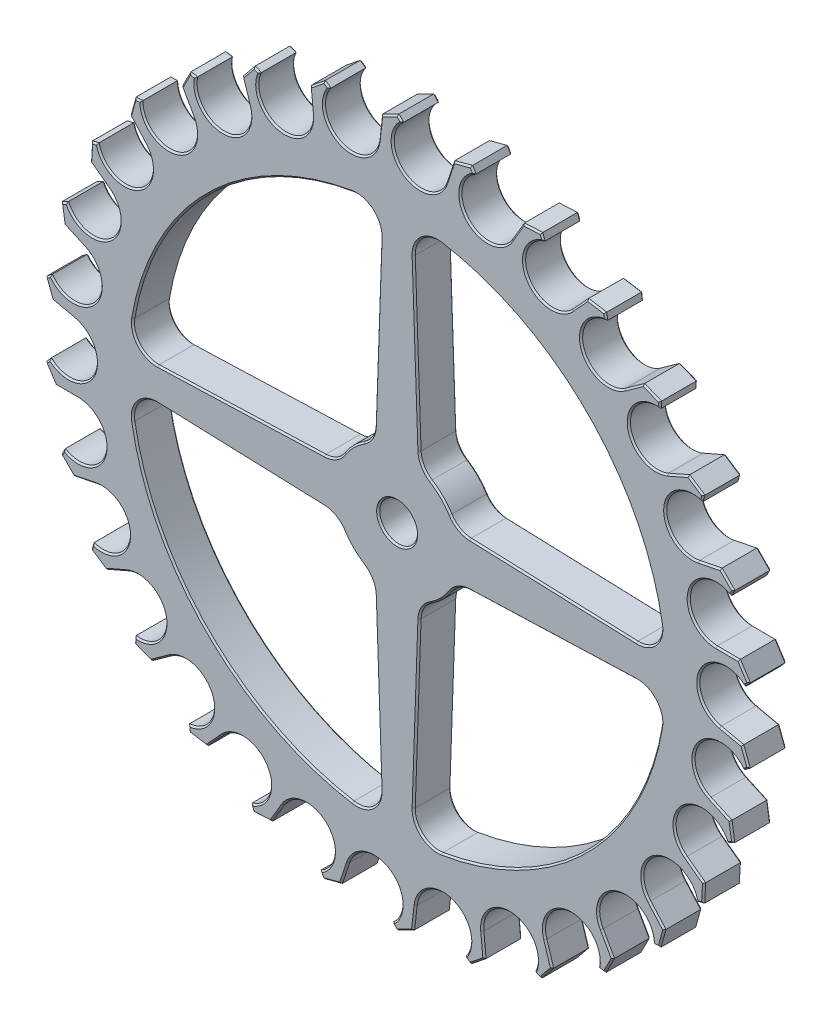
SolidWorks part; units mm, degrees
ref_plane "Спереди" through (0, 0, 0) normal (0, 0, 1) x (1, 0, 0)
ref_plane "Сверху" through (0, 0, 0) normal (0, 1, 0) x (1, 0, 0)
ref_plane "Справа" through (0, 0, 0) normal (1, 0, 0) x (0, 0, -1)
sketch "Эскиз1" plane through (0, 0, 0) normal (0, 0, 1) x (1, 0, 0)
  line L0 (0, 0) -> (-17.8603, 49.0707) construction
  line L1 (0, 0) -> (0, 56.16) construction
  line L2 (0, 0) -> (-56.16, 0) construction
  line L3 (-42.4277, 2.4783) -> (-56.1053, 2.4783) construction
  line L4 (-38.0173, 2.6323) -> (-11.5497, 3.5566)
  line L5 (-2.6323, 38.0173) -> (-3.5566, 11.5497)
  line L6 (-2.4783, 42.4277) -> (-2.4783, 56.1053) construction
  line L7 (38.0173, 2.6323) -> (11.5497, 3.5566)
  line L8 (2.6323, 38.0173) -> (3.5566, 11.5497)
  line L9 (2.6323, -38.0173) -> (3.5566, -11.5497)
  line L10 (38.0173, -2.6323) -> (11.5497, -3.5566)
  line L11 (-38.0173, -2.6323) -> (-11.5497, -3.5566)
  line L12 (-2.6323, -38.0173) -> (-3.5566, -11.5497)
  line L13 (0, 0) -> (-14.0055, 54.3856) construction
  line L14 (-13.8829, 53.1219) -> (-13.5306, 49.4908)
  line L15 (0, 0) -> (-11.6188, 54.945) construction
  line L16 (-11.6188, 54.945) -> (-13.8829, 53.1219)
  line L17 (-11.6188, 54.945) -> (-10.7339, 54.34)
  line L18 (0, 0) -> (-7.2676, 51.7118) construction
  line L19 (-2.5348, 54.8475) -> (-2.9452, 51.2225)
  line L20 (0.0588, 56.16) -> (-2.5348, 54.8475)
  line L21 (0.0588, 56.16) -> (0.7986, 55.3842)
  line L22 (8.924, 54.176) -> (7.7689, 50.7155)
  line L23 (11.7338, 54.9205) -> (8.924, 54.176)
  line L24 (11.7338, 54.9205) -> (12.2962, 54.0079)
  line L25 (19.9928, 51.1367) -> (18.1435, 47.992)
  line L26 (22.896, 51.2808) -> (19.9928, 51.1367)
  line L27 (22.896, 51.2808) -> (23.2563, 50.2712)
  line L28 (30.1878, 45.8625) -> (27.7251, 43.171)
  line L29 (33.0576, 45.3998) -> (30.1878, 45.8625)
  line L30 (33.0576, 45.3998) -> (33.2001, 44.3374)
  line L31 (39.0635, 38.5839) -> (36.095, 36.4633)
  line L32 (41.7743, 37.5346) -> (39.0635, 38.5839)
  line L33 (41.7743, 37.5346) -> (41.6929, 36.4658)
  line L34 (46.2319, 29.619) -> (42.8873, 28.1619)
  line L35 (48.6654, 28.0291) -> (46.2319, 29.619)
  line L36 (48.6654, 28.0291) -> (48.3635, 27.0005)
  line L37 (51.3797, 19.3596) -> (47.8053, 18.6297)
  line L38 (53.4295, 17.2985) -> (51.3797, 19.3596)
  line L39 (53.4295, 17.2985) -> (52.9203, 16.3552)
  line L40 (54.2821, 8.2541) -> (50.634, 8.2833)
  line L41 (55.8585, 5.8118) -> (54.2821, 8.2541)
  line L42 (55.8585, 5.8118) -> (55.1643, 4.995)
  line L43 (54.812, -3.2122) -> (51.2497, -2.4251)
  line L44 (55.8462, -5.9288) -> (54.812, -3.2122)
  line L45 (55.8462, -5.9288) -> (54.9974, -6.5834)
  line L46 (52.9464, -14.538) -> (49.6256, -13.0275)
  line L47 (53.3931, -17.4103) -> (52.9464, -14.538)
  line L48 (53.3931, -17.4103) -> (52.4268, -17.8742)
  line L49 (48.7667, -25.2285) -> (45.8326, -23.0606)
  line L50 (48.6066, -28.1309) -> (48.7667, -25.2285)
  line L51 (48.6066, -28.1309) -> (47.5649, -28.3837)
  line L52 (42.4558, -34.8164) -> (40.0365, -32.0858)
  line L53 (41.6956, -37.6221) -> (42.4558, -34.8164)
  line L54 (41.6956, -37.6221) -> (40.6242, -37.6528)
  line L55 (34.2893, -42.8826) -> (32.4906, -39.7087)
  line L56 (32.9624, -45.4689) -> (34.2893, -42.8826)
  line L57 (32.9624, -45.4689) -> (31.908, -45.2762)
  line L58 (24.6242, -49.0746) -> (23.5247, -45.5961)
  line L59 (22.7886, -51.3286) -> (24.6242, -49.0746)
  line L60 (22.7886, -51.3286) -> (21.7973, -50.9208)
  line L61 (13.8829, -53.1219) -> (13.5306, -49.4908)
  line L62 (11.6188, -54.945) -> (13.8829, -53.1219)
  line L63 (11.6188, -54.945) -> (10.7339, -54.34)
  line L64 (2.5348, -54.8475) -> (2.9452, -51.2225)
  line L65 (-0.0588, -56.16) -> (2.5348, -54.8475)
  line L66 (-0.0588, -56.16) -> (-0.7986, -55.3842)
  line L67 (-8.924, -54.176) -> (-7.7689, -50.7155)
  line L68 (-11.7338, -54.9205) -> (-8.924, -54.176)
  line L69 (-11.7338, -54.9205) -> (-12.2962, -54.0079)
  line L70 (-19.9928, -51.1367) -> (-18.1435, -47.992)
  line L71 (-22.896, -51.2808) -> (-19.9928, -51.1367)
  line L72 (-22.896, -51.2808) -> (-23.2563, -50.2712)
  line L73 (-30.1878, -45.8625) -> (-27.7251, -43.171)
  line L74 (-33.0576, -45.3998) -> (-30.1878, -45.8625)
  line L75 (-33.0576, -45.3998) -> (-33.2001, -44.3374)
  line L76 (-39.0635, -38.5839) -> (-36.095, -36.4633)
  line L77 (-41.7743, -37.5346) -> (-39.0635, -38.5839)
  line L78 (-41.7743, -37.5346) -> (-41.6929, -36.4658)
  line L79 (-46.2319, -29.619) -> (-42.8873, -28.1619)
  line L80 (-48.6654, -28.0291) -> (-46.2319, -29.619)
  line L81 (-48.6654, -28.0291) -> (-48.3635, -27.0005)
  line L82 (-51.3797, -19.3596) -> (-47.8053, -18.6297)
  line L83 (-53.4295, -17.2985) -> (-51.3797, -19.3596)
  line L84 (-53.4295, -17.2985) -> (-52.9203, -16.3552)
  line L85 (-54.2821, -8.2541) -> (-50.634, -8.2833)
  line L86 (-55.8585, -5.8118) -> (-54.2821, -8.2541)
  line L87 (-55.8585, -5.8118) -> (-55.1643, -4.995)
  line L88 (-54.812, 3.2122) -> (-51.2497, 2.4251)
  line L89 (-55.8462, 5.9288) -> (-54.812, 3.2122)
  line L90 (-55.8462, 5.9288) -> (-54.9974, 6.5834)
  line L91 (-52.9464, 14.538) -> (-49.6256, 13.0275)
  line L92 (-53.3931, 17.4103) -> (-52.9464, 14.538)
  line L93 (-53.3931, 17.4103) -> (-52.4268, 17.8742)
  line L94 (-48.7667, 25.2285) -> (-45.8326, 23.0606)
  line L95 (-48.6066, 28.1309) -> (-48.7667, 25.2285)
  line L96 (-48.6066, 28.1309) -> (-47.5649, 28.3837)
  line L97 (-42.4558, 34.8164) -> (-40.0365, 32.0858)
  line L98 (-41.6956, 37.6221) -> (-42.4558, 34.8164)
  line L99 (-41.6956, 37.6221) -> (-40.6242, 37.6528)
  line L100 (-34.2893, 42.8826) -> (-32.4906, 39.7087)
  line L101 (-32.9624, 45.4689) -> (-34.2893, 42.8826)
  line L102 (-32.9624, 45.4689) -> (-31.908, 45.2762)
  line L103 (-24.6242, 49.0746) -> (-23.5247, 45.5961)
  line L104 (-22.7886, 51.3286) -> (-24.6242, 49.0746)
  line L105 (-22.7886, 51.3286) -> (-21.7973, 50.9208)
  circle A0 centre (0, 0) radius 56.16 construction
  circle A1 centre (0, 0) radius 52.22 construction
  arc A2 (-21.7973, 50.9208) -> (-13.5306, 49.4908) centre (-17.8603, 49.0707) ccw
  circle A3 centre (0, 0) radius 3
  arc A4 (-5.3326, 8.4595) -> (-8.4595, 5.3326) centre (0, 0) ccw
  arc A5 (-7.0742, 41.9071) -> (-41.9071, 7.0742) centre (0, 0) ccw
  arc A6 (-3.5566, 11.5497) -> (-5.3326, 8.4595) centre (-7.3643, 11.6826) cw
  arc A7 (-11.5497, 3.5566) -> (-8.4595, 5.3326) centre (-11.6826, 7.3643) ccw
  arc A8 (-41.9071, 7.0742) -> (-38.0173, 2.6323) centre (-38.1503, 6.44) ccw
  arc A9 (-7.0742, 41.9071) -> (-2.6323, 38.0173) centre (-6.44, 38.1503) cw
  arc A10 (41.9071, 7.0742) -> (7.0742, 41.9071) centre (0, 0) ccw
  arc A11 (41.9071, 7.0742) -> (38.0173, 2.6323) centre (38.1503, 6.44) cw
  arc A12 (7.0742, 41.9071) -> (2.6323, 38.0173) centre (6.44, 38.1503) ccw
  arc A13 (3.5566, 11.5497) -> (5.3326, 8.4595) centre (7.3643, 11.6826) ccw
  arc A14 (8.4595, 5.3326) -> (5.3326, 8.4595) centre (0, 0) ccw
  arc A15 (11.5497, 3.5566) -> (8.4595, 5.3326) centre (11.6826, 7.3643) cw
  arc A16 (7.0742, -41.9071) -> (41.9071, -7.0742) centre (0, 0) ccw
  arc A17 (7.0742, -41.9071) -> (2.6323, -38.0173) centre (6.44, -38.1503) cw
  arc A18 (41.9071, -7.0742) -> (38.0173, -2.6323) centre (38.1503, -6.44) ccw
  arc A19 (11.5497, -3.5566) -> (8.4595, -5.3326) centre (11.6826, -7.3643) ccw
  arc A20 (5.3326, -8.4595) -> (8.4595, -5.3326) centre (0, 0) ccw
  arc A21 (3.5566, -11.5497) -> (5.3326, -8.4595) centre (7.3643, -11.6826) cw
  arc A22 (-41.9071, -7.0742) -> (-7.0742, -41.9071) centre (0, 0) ccw
  arc A23 (-41.9071, -7.0742) -> (-38.0173, -2.6323) centre (-38.1503, -6.44) cw
  arc A24 (-7.0742, -41.9071) -> (-2.6323, -38.0173) centre (-6.44, -38.1503) ccw
  arc A25 (-3.5566, -11.5497) -> (-5.3326, -8.4595) centre (-7.3643, -11.6826) ccw
  arc A26 (-8.4595, -5.3326) -> (-5.3326, -8.4595) centre (0, 0) ccw
  arc A27 (-11.5497, -3.5566) -> (-8.4595, -5.3326) centre (-11.6826, -7.3643) cw
  arc A28 (-10.7339, 54.34) -> (-2.9452, 51.2225) centre (-7.2676, 51.7118) ccw
  arc A29 (0.7986, 55.3842) -> (7.7689, 50.7155) centre (3.6427, 52.0928) ccw
  arc A30 (12.2962, 54.0079) -> (18.1435, 47.992) centre (14.3938, 50.1971) ccw
  arc A31 (23.2563, 50.2712) -> (27.7251, 43.171) centre (24.5158, 46.1075) ccw
  arc A32 (33.2001, 44.3374) -> (36.095, 36.4633) centre (33.5664, 40.0028) ccw
  arc A33 (41.6929, 36.4658) -> (42.8873, 28.1619) centre (41.1499, 32.1498) ccw
  arc A34 (48.3635, 27.0005) -> (47.8053, 18.6297) centre (46.935, 22.8917) ccw
  arc A35 (52.9203, 16.3552) -> (50.634, 8.2833) centre (50.6688, 12.6332) ccw
  arc A36 (55.1643, 4.995) -> (51.2497, -2.4251) centre (52.1882, 1.8225) ccw
  arc A37 (54.9974, -6.5834) -> (49.6256, -13.0275) centre (51.4267, -9.0679) ccw
  arc A38 (52.4268, -17.8742) -> (45.8326, -23.0606) centre (48.4175, -19.562) ccw
  arc A39 (47.5649, -28.3837) -> (40.0365, -32.0858) centre (43.2923, -29.2011) ccw
  arc A40 (40.6242, -37.6528) -> (32.4906, -39.7087) centre (36.2751, -37.5639) ccw
  arc A41 (31.908, -45.2762) -> (23.5247, -45.5961) centre (27.6724, -44.2851) ccw
  arc A42 (21.7973, -50.9208) -> (13.5306, -49.4908) centre (17.8603, -49.0707) ccw
  arc A43 (10.7339, -54.34) -> (2.9452, -51.2225) centre (7.2676, -51.7118) ccw
  arc A44 (-0.7986, -55.3842) -> (-7.7689, -50.7155) centre (-3.6427, -52.0928) ccw
  arc A45 (-12.2962, -54.0079) -> (-18.1435, -47.992) centre (-14.3938, -50.1971) ccw
  arc A46 (-23.2563, -50.2712) -> (-27.7251, -43.171) centre (-24.5158, -46.1075) ccw
  arc A47 (-33.2001, -44.3374) -> (-36.095, -36.4633) centre (-33.5664, -40.0028) ccw
  arc A48 (-41.6929, -36.4658) -> (-42.8873, -28.1619) centre (-41.1499, -32.1498) ccw
  arc A49 (-48.3635, -27.0005) -> (-47.8053, -18.6297) centre (-46.935, -22.8917) ccw
  arc A50 (-52.9203, -16.3552) -> (-50.634, -8.2833) centre (-50.6688, -12.6332) ccw
  arc A52 (-55.1643, -4.995) -> (-51.2497, 2.4251) centre (-52.1882, -1.8225) ccw
  arc A53 (-52.4268, 17.8742) -> (-45.8326, 23.0606) centre (-48.4175, 19.562) ccw
  arc A54 (-47.5649, 28.3837) -> (-40.0365, 32.0858) centre (-43.2923, 29.2011) ccw
  arc A55 (-54.9974, 6.5834) -> (-49.6256, 13.0275) centre (-51.4267, 9.0679) ccw
  arc A56 (-31.908, 45.2762) -> (-23.5247, 45.5961) centre (-27.6724, 44.2851) ccw
  arc A57 (-40.6242, 37.6528) -> (-32.4906, 39.7087) centre (-36.2751, 37.5639) ccw
  dimension "D1" = 112.32
  dimension "D2" = 104.44
  dimension "D4" = 8.7
  dimension "D5" = 6
  dimension "D6" = 20
  dimension "D7" = 85
  dimension "D12" = 3.81
  dimension "D3" = 20
  dimension "D8" = 2.4783
  dimension "D9" = 2
  dimension "D10" = 2.4783
  dimension "D11" = 2
  dimension "D14" = 8.9
  dimension "D15" = 8.06
  dimension "D16" = 123.3
  dimension "D17" = 106.8
  dimension "D19" = 12
  dimension "D13" = 4
  dimension "D20" = 30
extrude "Бобышка-Вытянуть1" add sketch "Эскиз1" along normal blind 6
chamfer "Фаска1" distance 0.25 angle 45 306 edges at (-7.0711, -7.0711, 0) (-4.061, -9.7841, 0) (-3.0944, -24.7835, 0) (-3.9299, -41.0166, 0) (-30.052, -30.052, 0) (-41.0166, -3.9299, 0) (-24.7835, -3.0944, 0) (-9.7841, -4.061, 0) (7.0711, 7.0711, 0) (4.061, 9.7841, 0) (3.0944, 24.7835, 0) (3.9299, 41.0166, 0) (30.052, 30.052, 0) (41.0166, 3.9299, 0) (24.7835, 3.0944, 0) (9.7841, 4.061, 0) (3, 0, 0) (-13.7068, 51.3063, 0) (-18.6018, 44.7844, 0) (-22.2929, 51.1247, 0) (-23.7064, 50.2016, 0) (-24.0744, 47.3354, 0) (-27.5065, 39.9382, 0) (-32.4352, 45.3726, 0) (-33.6258, 44.1758, 0) (-33.3899, 41.2956, 0) (-35.209, 33.3466, 0) (-41.1599, 37.6374, 0) (-42.0757, 36.2192, 0) (-41.2461, 33.4511, 0) (-41.3728, 25.2975, 0) (-48.0857, 28.2573, 0) (-48.6866, 26.6797, 0) (-47.2997, 24.1445, 0) (-45.7283, 16.1428, 0) (-52.9099, 17.6422, 0) (-53.1697, 15.9742, 0) (-51.286, 13.7828, 0) (-48.0853, 6.2826, 0) (-55.4218, 6.2561, 0) (-55.3291, 4.5705, 0) (-53.0309, 2.8186, 0) (-48.3408, -3.8522, 0) (-55.5114, -5.4034, 0) (-55.0703, -7.033, 0) (-52.458, -8.2687, 0) (-46.4835, -13.8186, 0) (-53.1749, -16.8268, 0) (-52.4046, -18.329, 0) (-49.5925, -18.9946, 0) (-42.5947, -23.1811, 0) (-48.5144, -27.5148, 0) (-47.4486, -28.824, 0) (-44.5596, -28.8904, 0) (-36.8442, -31.5305, 0) (-41.7336, -37.0002, 0) (-40.4189, -38.0593, 0) (-37.5792, -37.5236, 0) (-29.4835, -38.5018, 0) (-33.1288, -44.8686, 0) (-31.6227, -45.6311, 0) (-28.9564, -44.5167, 0) (-20.8343, -43.7904, 0) (-23.0762, -50.776, 0) (-21.4444, -51.2087, 0) (-19.0681, -49.5643, 0) (-11.2745, -47.1652, 0) (-12.015, -54.4642, 0) (-10.3289, -54.5482, 0) (-8.3464, -52.4457, 0) (-1.2219, -48.4786, 0) (-0.4287, -55.7721, 0) (1.238, -55.5037, 0) (2.74, -53.035, 0) (8.8841, -47.6733, 0) (11.1763, -54.6425, 0) (12.7508, -54.0334, 0) (13.7068, -51.3063, 0) (18.6018, -44.7844, 0) (22.2929, -51.1247, 0) (23.7064, -50.2016, 0) (24.0744, -47.3354, 0) (27.5065, -39.9382, 0) (32.4352, -45.3726, 0) (33.6258, -44.1758, 0) (33.3899, -41.2956, 0) (35.209, -33.3466, 0) (41.1599, -37.6374, 0) (42.0757, -36.2192, 0) (41.2461, -33.4511, 0) (41.3728, -25.2975, 0) (48.0857, -28.2573, 0) (48.6866, -26.6797, 0) (47.2997, -24.1445, 0) (45.7283, -16.1428, 0) (52.9099, -17.6422, 0) (53.1697, -15.9742, 0) (51.286, -13.7828, 0) (48.0853, -6.2826, 0) (55.4218, -6.2561, 0) (55.3291, -4.5705, 0) (53.0309, -2.8186, 0) (48.3408, 3.8522, 0) (55.5114, 5.4034, 0) (55.0703, 7.033, 0) (52.458, 8.2687, 0) (46.4835, 13.8186, 0) (53.1749, 16.8268, 0) (52.4046, 18.329, 0) (49.5925, 18.9946, 0) (42.5947, 23.1811, 0) (48.5144, 27.5148, 0) (47.4486, 28.824, 0) (44.5596, 28.8904, 0) (36.8442, 31.5305, 0) (41.7336, 37.0002, 0) (40.4189, 38.0593, 0) (37.5792, 37.5236, 0) (29.4835, 38.5018, 0) (33.1288, 44.8686, 0) (31.6227, 45.6311, 0) (28.9564, 44.5167, 0) (20.8343, 43.7904, 0) (23.0762, 50.776, 0) (21.4444, 51.2087, 0) (19.0681, 49.5643, 0) (11.2745, 47.1652, 0) (12.015, 54.4642, 0) (10.3289, 54.5482, 0) (8.3464, 52.4457, 0) (1.2219, 48.4786, 0) (0.4287, 55.7721, 0) (-1.238, 55.5037, 0) (-2.74, 53.035, 0) (-8.8841, 47.6733, 0) (-11.1763, 54.6425, 0) (-12.7508, 54.0334, 0) (-7.0711, 7.0711, 0) (-9.7841, 4.061, 0) (-24.7835, 3.0944, 0) (-41.0166, 3.9299, 0) (-30.052, 30.052, 0) (-3.9299, 41.0166, 0) (-3.0944, 24.7835, 0) (-4.061, 9.7841, 0) (7.0711, -7.0711, 0) (9.7841, -4.061, 0) (24.7835, -3.0944, 0) (41.0166, -3.9299, 0) (30.052, -30.052, 0) (3.9299, -41.0166, 0) (3.0944, -24.7835, 0) (4.061, -9.7841, 0) (-41.0166, -3.9299, 6) (-30.052, -30.052, 6) (-3.9299, -41.0166, 6) (-3.0944, -24.7835, 6) (-4.061, -9.7841, 6) (-7.0711, -7.0711, 6) (-9.7841, -4.061, 6) (-24.7835, -3.0944, 6) (41.0166, 3.9299, 6) (30.052, 30.052, 6) (3.9299, 41.0166, 6) (3.0944, 24.7835, 6) (4.061, 9.7841, 6) (7.0711, 7.0711, 6) (9.7841, 4.061, 6) (24.7835, 3.0944, 6) (3, 0, 6) (-11.1763, 54.6425, 6) (-8.8841, 47.6733, 6) (-2.74, 53.035, 6) (-1.238, 55.5037, 6) (0.4287, 55.7721, 6) (1.2219, 48.4786, 6) (8.3464, 52.4457, 6) (10.3289, 54.5482, 6) (12.015, 54.4642, 6) (11.2745, 47.1652, 6) (19.0681, 49.5643, 6) (21.4444, 51.2087, 6) (23.0762, 50.776, 6) (20.8343, 43.7904, 6) (28.9564, 44.5167, 6) (31.6227, 45.6311, 6) (33.1288, 44.8686, 6) (29.4835, 38.5018, 6) (37.5792, 37.5236, 6) (40.4189, 38.0593, 6) (41.7336, 37.0002, 6) (36.8442, 31.5305, 6) (44.5596, 28.8904, 6) (47.4486, 28.824, 6) (48.5144, 27.5148, 6) (42.5947, 23.1811, 6) (49.5925, 18.9946, 6) (52.4046, 18.329, 6) (53.1749, 16.8268, 6) (46.4835, 13.8186, 6) (52.458, 8.2687, 6) (55.0703, 7.033, 6) (55.5114, 5.4034, 6) (48.3408, 3.8522, 6) (53.0309, -2.8186, 6) (55.3291, -4.5705, 6) (55.4218, -6.2561, 6) (48.0853, -6.2826, 6) (51.286, -13.7828, 6) (53.1697, -15.9742, 6) (52.9099, -17.6422, 6) (45.7283, -16.1428, 6) (47.2997, -24.1445, 6) (48.6866, -26.6797, 6) (48.0857, -28.2573, 6) (41.3728, -25.2975, 6) (41.2461, -33.4511, 6) (42.0757, -36.2192, 6) (41.1599, -37.6374, 6) (35.209, -33.3466, 6) (33.3899, -41.2956, 6) (33.6258, -44.1758, 6) (32.4352, -45.3726, 6) (27.5065, -39.9382, 6) (24.0744, -47.3354, 6) (23.7064, -50.2016, 6) (22.2929, -51.1247, 6) (18.6018, -44.7844, 6) (13.7068, -51.3063, 6) (12.7508, -54.0334, 6) (11.1763, -54.6425, 6) (8.8841, -47.6733, 6) (2.74, -53.035, 6) (1.238, -55.5037, 6) (-0.4287, -55.7721, 6) (-1.2219, -48.4786, 6) (-8.3464, -52.4457, 6) (-10.3289, -54.5482, 6) (-12.015, -54.4642, 6) (-11.2745, -47.1652, 6) (-19.0681, -49.5643, 6) (-21.4444, -51.2087, 6) (-23.0762, -50.776, 6) (-20.8343, -43.7904, 6) (-28.9564, -44.5167, 6) (-31.6227, -45.6311, 6) (-33.1288, -44.8686, 6) (-29.4835, -38.5018, 6) (-37.5792, -37.5236, 6) (-40.4189, -38.0593, 6) (-41.7336, -37.0002, 6) (-36.8442, -31.5305, 6) (-44.5596, -28.8904, 6) (-47.4486, -28.824, 6) (-48.5144, -27.5148, 6) (-42.5947, -23.1811, 6) (-49.5925, -18.9946, 6) (-52.4046, -18.329, 6) (-53.1749, -16.8268, 6) (-46.4835, -13.8186, 6) (-52.458, -8.2687, 6) (-55.0703, -7.033, 6) (-55.5114, -5.4034, 6) (-48.3408, -3.8522, 6) (-53.0309, 2.8186, 6) (-55.3291, 4.5705, 6) (-55.4218, 6.2561, 6) (-48.0853, 6.2826, 6) (-51.286, 13.7828, 6) (-53.1697, 15.9742, 6) (-52.9099, 17.6422, 6) (-45.7283, 16.1428, 6) (-47.2997, 24.1445, 6) (-48.6866, 26.6797, 6) (-48.0857, 28.2573, 6) (-41.3728, 25.2975, 6) (-41.2461, 33.4511, 6) (-42.0757, 36.2192, 6) (-41.1599, 37.6374, 6) (-35.209, 33.3466, 6) (-33.3899, 41.2956, 6) (-33.6258, 44.1758, 6) (-32.4352, 45.3726, 6) (-27.5065, 39.9382, 6) (-24.0744, 47.3354, 6) (-23.7064, 50.2016, 6) (-22.2929, 51.1247, 6) (-18.6018, 44.7844, 6) (-13.7068, 51.3063, 6) (-12.7508, 54.0334, 6) (-3.9299, 41.0166, 6) (-30.052, 30.052, 6) (-41.0166, 3.9299, 6) (-24.7835, 3.0944, 6) (-9.7841, 4.061, 6) (-7.0711, 7.0711, 6) (-4.061, 9.7841, 6) (-3.0944, 24.7835, 6) (3.9299, -41.0166, 6) (30.052, -30.052, 6) (41.0166, -3.9299, 6) (24.7835, -3.0944, 6) (9.7841, -4.061, 6) (7.0711, -7.0711, 6) (4.061, -9.7841, 6) (3.0944, -24.7835, 6)
